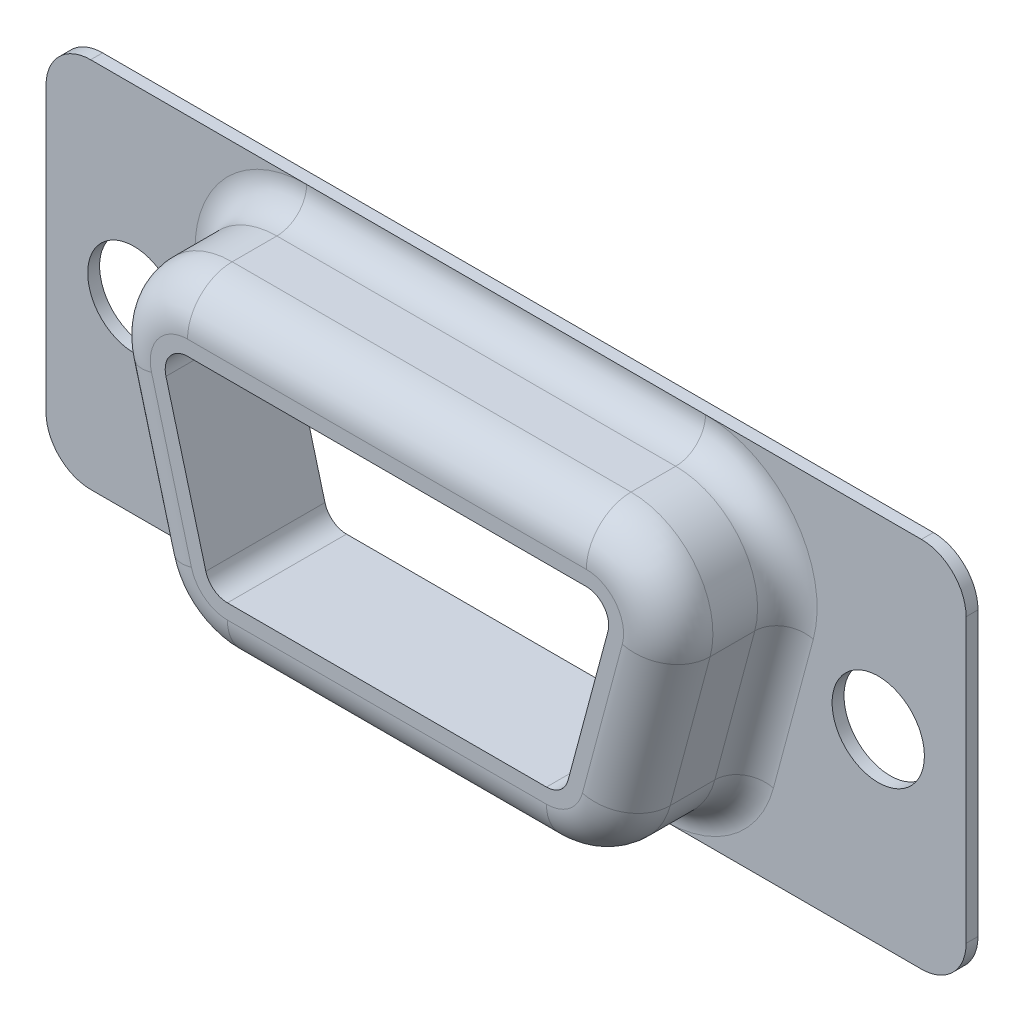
SolidWorks part; units mm, degrees
ref_plane "Front Plane" through (0, 0, 0) normal (0, 0, 1) x (1, 0, 0)
ref_plane "Top Plane" through (0, 0, 0) normal (0, 1, 0) x (1, 0, 0)
ref_plane "Right Plane" through (0, 0, 0) normal (1, 0, 0) x (0, 0, -1)
sketch "Sketch1" plane through (0, 0, 0) normal (0, 0, 1) x (1, 0, 0)
  line L0 (-135.2667, 0) -> (178.1738, 0) construction
  line L1 (0, 93.814) -> (0, -102.1772) construction
  line L2 (-8.146, 2.1118) -> (-6.8062, -2.8882)
  line L3 (-13.95, 6.25) -> (13.95, 6.25)
  line L4 (-15.45, 4.75) -> (-15.45, -4.75)
  line L5 (-13.95, -6.25) -> (13.95, -6.25)
  line L6 (15.45, 4.75) -> (15.45, -4.75)
  line L7 (-15.45, 6.25) -> (15.45, -6.25) construction
  line L8 (-15.45, -6.25) -> (15.45, 6.25) construction
  line L9 (-6.6971, 4) -> (6.75, 4)
  line L10 (8.146, 2.1118) -> (6.8062, -2.8882)
  line L11 (-5.3573, -4) -> (5.3573, -4)
  line L13 (-8.25, 4) -> (8.25, -4) construction
  line L14 (-8.25, -4) -> (8.25, 4) construction
  circle A0 centre (-12.5, 0) radius 1.55
  circle A1 centre (12.5, 0) radius 1.55
  arc A2 (8.146, 2.1118) -> (6.6971, 4) centre (6.6971, 2.5) ccw
  arc A3 (-8.146, 2.1118) -> (-6.6971, 4) centre (-6.6971, 2.5) cw
  arc A4 (5.3573, -4) -> (6.8062, -2.8882) centre (5.3573, -2.5) ccw
  arc A5 (-6.8062, -2.8882) -> (-5.3573, -4) centre (-5.3573, -2.5) ccw
  arc A6 (13.95, 6.25) -> (15.45, 4.75) centre (13.95, 4.75) cw
  arc A7 (13.95, -6.25) -> (15.45, -4.75) centre (13.95, -4.75) ccw
  arc A8 (-15.45, -4.75) -> (-13.95, -6.25) centre (-13.95, -4.75) ccw
  arc A9 (-13.95, 6.25) -> (-15.45, 4.75) centre (-13.95, 4.75) ccw
  point P5 (0, 0)
  point P14 (0, 0)
  dimension "D1" = 16.5
  dimension "D6" = 1.5
  dimension "D7" = 1.5
  dimension "D2" = 1.5
  dimension "D8" = 3.1
  dimension "D3" = 30.9
  dimension "D4" = 12.5
  dimension "D5" = 12.5
extrude "Boss-Extrude1" add sketch "Sketch1" along normal blind 0.4
sketch "Sketch2" plane through (0, 0, 0.4) normal (0, 0, 1) x (1, 0, 0)
  line L0 (-5.3573, -3.25) -> (5.3573, -3.25)
  line L1 (6.0818, -2.6941) -> (7.4215, 2.3059)
  line L2 (6.6971, 3.25) -> (-6.6971, 3.25)
  line L3 (-7.4215, 2.3059) -> (-6.0818, -2.6941)
  line L9 (-9.3534, 1.7882) -> (-8.0136, -3.2118)
  line L10 (-5.3573, -5.25) -> (5.3573, -5.25)
  line L11 (8.0136, -3.2118) -> (9.3534, 1.7882)
  line L12 (6.6971, 5.25) -> (-6.6971, 5.25)
  line L13 (-9.3534, 1.7882) -> (-8.0136, -3.2118)
  line L14 (-5.3573, -5.25) -> (5.3573, -5.25)
  line L15 (8.0136, -3.2118) -> (9.3534, 1.7882)
  line L16 (6.6971, 5.25) -> (-6.6971, 5.25)
  line L21 (6.6971, 4) -> (-6.6971, 4)
  line L22 (6.8062, -2.8882) -> (8.146, 2.1118)
  line L23 (-5.3573, -4) -> (5.3573, -4)
  line L24 (-8.146, 2.1118) -> (-6.8062, -2.8882)
  line L25 (6.6971, 4) -> (-6.6971, 4) construction
  line L26 (6.8062, -2.8882) -> (8.146, 2.1118) construction
  line L27 (-5.3573, -4) -> (5.3573, -4) construction
  line L28 (-8.146, 2.1118) -> (-6.8062, -2.8882) construction
  arc A0 (5.3573, -3.25) -> (6.0818, -2.6941) centre (5.3573, -2.5) ccw
  arc A1 (7.4215, 2.3059) -> (6.6971, 3.25) centre (6.6971, 2.5) ccw
  arc A2 (-6.6971, 3.25) -> (-7.4215, 2.3059) centre (-6.6971, 2.5) ccw
  arc A3 (-6.0818, -2.6941) -> (-5.3573, -3.25) centre (-5.3573, -2.5) ccw
  arc A8 (-8.0136, -3.2118) -> (-5.3573, -5.25) centre (-5.3573, -2.5) ccw
  arc A9 (5.3573, -5.25) -> (8.0136, -3.2118) centre (5.3573, -2.5) ccw
  arc A10 (9.3534, 1.7882) -> (6.6971, 5.25) centre (6.6971, 2.5) ccw
  arc A11 (-6.6971, 5.25) -> (-9.3534, 1.7882) centre (-6.6971, 2.5) ccw
  arc A12 (-8.0136, -3.2118) -> (-5.3573, -5.25) centre (-5.3573, -2.5) ccw
  arc A13 (5.3573, -5.25) -> (8.0136, -3.2118) centre (5.3573, -2.5) ccw
  arc A14 (9.3534, 1.7882) -> (6.6971, 5.25) centre (6.6971, 2.5) ccw
  arc A15 (-6.6971, 5.25) -> (-9.3534, 1.7882) centre (-6.6971, 2.5) ccw
  arc A20 (-6.6971, 4) -> (-8.146, 2.1118) centre (-6.6971, 2.5) ccw
  arc A21 (8.146, 2.1118) -> (6.6971, 4) centre (6.6971, 2.5) ccw
  arc A22 (5.3573, -4) -> (6.8062, -2.8882) centre (5.3573, -2.5) ccw
  arc A23 (-6.8062, -2.8882) -> (-5.3573, -4) centre (-5.3573, -2.5) ccw
  arc A24 (-6.6971, 4) -> (-8.146, 2.1118) centre (-6.6971, 2.5) ccw construction
  arc A25 (8.146, 2.1118) -> (6.6971, 4) centre (6.6971, 2.5) ccw construction
  arc A26 (5.3573, -4) -> (6.8062, -2.8882) centre (5.3573, -2.5) ccw construction
  arc A27 (-6.8062, -2.8882) -> (-5.3573, -4) centre (-5.3573, -2.5) ccw construction
  dimension "D3" = 0.75
  dimension "D1" = 1.25
  dimension "D2" = 0
extrude "Boss-Extrude2" add sketch "Sketch2" along normal blind 4
fillet "Fillet1" radius 1 8 edges at (-8.6835, -0.7118, 0.4) (-8.8788, 4.1741, 0.4) (0, 5.25, 0.4) (8.8788, 4.1741, 0.4) (8.6835, -0.7118, 0.4) (7.0314, -4.6817, 0.4) (0, -5.25, 0.4) (-7.0314, -4.6817, 0.4)
fillet "Fillet2" radius 1.5 8 edges at (-8.8788, 4.1741, 4.4) (0, 5.25, 4.4) (8.8788, 4.1741, 4.4) (8.6835, -0.7118, 4.4) (7.0314, -4.6817, 4.4) (0, -5.25, 4.4) (-7.0314, -4.6817, 4.4) (-8.6835, -0.7118, 4.4)
